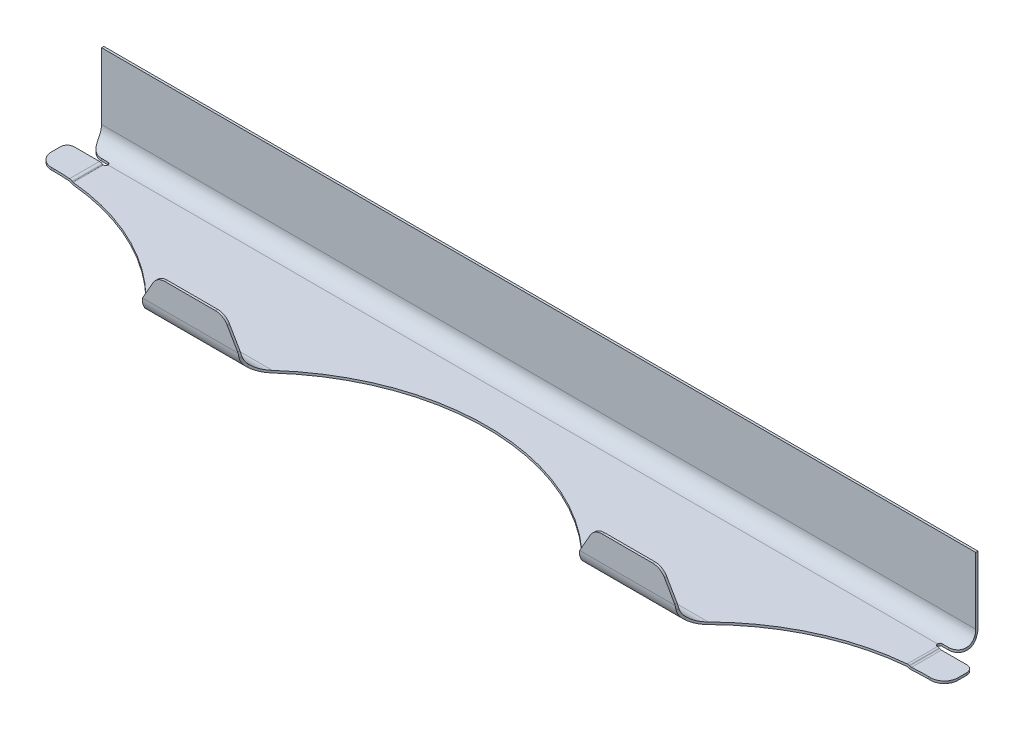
SolidWorks part; units mm, degrees
ref_plane "Front Plane" through (0, 0, 0) normal (1, 0, 0) x (0, 1, 0)
ref_plane "Top Plane" through (0, 0, 0) normal (0, 0, 1) x (0, 1, 0)
ref_plane "Right Plane" through (0, 0, 0) normal (0, 1, 0) x (-1, 0, 0)
sketch "sk 5dia hole pat" plane through (0, 0, 0) normal (0, 0, 1) x (0, 1, 0)
  line L4 (-30.48, -48.26) -> (30.48, -48.26) construction
  point P3 (0, -48.26)
  circle B0 centre (30.48, -579.12) radius 4.826
  circle B1 centre (1188.72, 579.12) radius 4.826
  circle B2 centre (78.74, -579.12) radius 4.826
  circle B3 centre (127, -579.12) radius 4.826
  circle B4 centre (175.26, -579.12) radius 4.826
  circle B5 centre (223.52, -579.12) radius 4.826
  circle B6 centre (271.78, -579.12) radius 4.826
  circle B7 centre (320.04, -579.12) radius 4.826
  circle B8 centre (368.3, -579.12) radius 4.826
  circle B9 centre (416.56, -579.12) radius 4.826
  circle B10 centre (464.82, -579.12) radius 4.826
  circle B11 centre (513.08, -579.12) radius 4.826
  circle B12 centre (561.34, -579.12) radius 4.826
  circle B13 centre (609.6, -579.12) radius 4.826
  circle B14 centre (657.86, -579.12) radius 4.826
  circle B15 centre (706.12, -579.12) radius 4.826
  circle B16 centre (754.38, -579.12) radius 4.826
  circle B17 centre (802.64, -579.12) radius 4.826
  circle B18 centre (850.9, -579.12) radius 4.826
  circle B19 centre (899.16, -579.12) radius 4.826
  circle B20 centre (947.42, -579.12) radius 4.826
  circle B21 centre (995.68, -579.12) radius 4.826
  circle B22 centre (1043.94, -579.12) radius 4.826
  circle B23 centre (1092.2, -579.12) radius 4.826
  circle B24 centre (1140.46, -579.12) radius 4.826
  circle B25 centre (1188.72, -579.12) radius 4.826
  circle B26 centre (30.48, -530.86) radius 4.826
  circle B27 centre (30.48, -482.6) radius 4.826
  circle B28 centre (30.48, -434.34) radius 4.826
  circle B29 centre (30.48, -386.08) radius 4.826
  circle B30 centre (30.48, -337.82) radius 4.826
  circle B31 centre (30.48, -289.56) radius 4.826
  circle B32 centre (30.48, -241.3) radius 4.826
  circle B33 centre (30.48, -193.04) radius 4.826
  circle B34 centre (30.48, -144.78) radius 4.826
  circle B35 centre (30.48, -96.52) radius 4.826
  circle B36 centre (30.48, -48.26) radius 4.826
  circle B37 centre (30.48, 0) radius 4.826
  circle B38 centre (30.48, 48.26) radius 4.826
  circle B39 centre (30.48, 96.52) radius 4.826
  circle B40 centre (30.48, 144.78) radius 4.826
  circle B41 centre (30.48, 193.04) radius 4.826
  circle B42 centre (30.48, 241.3) radius 4.826
  circle B43 centre (30.48, 289.56) radius 4.826
  circle B44 centre (30.48, 337.82) radius 4.826
  circle B45 centre (30.48, 386.08) radius 4.826
  circle B46 centre (30.48, 434.34) radius 4.826
  circle B47 centre (30.48, 482.6) radius 4.826
  circle B48 centre (30.48, 530.86) radius 4.826
  circle B49 centre (30.48, 579.12) radius 4.826
  circle B50 centre (1140.46, 579.12) radius 4.826
  circle B51 centre (1092.2, 579.12) radius 4.826
  circle B52 centre (1043.94, 579.12) radius 4.826
  circle B53 centre (995.68, 579.12) radius 4.826
  circle B54 centre (947.42, 579.12) radius 4.826
  circle B55 centre (899.16, 579.12) radius 4.826
  circle B56 centre (850.9, 579.12) radius 4.826
  circle B57 centre (802.64, 579.12) radius 4.826
  circle B58 centre (754.38, 579.12) radius 4.826
  circle B59 centre (706.12, 579.12) radius 4.826
  circle B60 centre (657.86, 579.12) radius 4.826
  circle B61 centre (609.6, 579.12) radius 4.826
  circle B62 centre (561.34, 579.12) radius 4.826
  circle B63 centre (513.08, 579.12) radius 4.826
  circle B64 centre (464.82, 579.12) radius 4.826
  circle B65 centre (416.56, 579.12) radius 4.826
  circle B66 centre (368.3, 579.12) radius 4.826
  circle B67 centre (320.04, 579.12) radius 4.826
  circle B68 centre (271.78, 579.12) radius 4.826
  circle B69 centre (223.52, 579.12) radius 4.826
  circle B70 centre (175.26, 579.12) radius 4.826
  circle B71 centre (127, 579.12) radius 4.826
  circle B72 centre (78.74, 579.12) radius 4.826
  circle B73 centre (1188.72, 530.86) radius 4.826
  circle B74 centre (1188.72, 482.6) radius 4.826
  circle B75 centre (1188.72, 434.34) radius 4.826
  circle B76 centre (1188.72, 386.08) radius 4.826
  circle B77 centre (1188.72, 337.82) radius 4.826
  circle B78 centre (1188.72, 289.56) radius 4.826
  circle B79 centre (1188.72, 241.3) radius 4.826
  circle B80 centre (1188.72, 193.04) radius 4.826
  circle B81 centre (1188.72, 144.78) radius 4.826
  circle B82 centre (1188.72, 96.52) radius 4.826
  circle B83 centre (1188.72, 48.26) radius 4.826
  circle B84 centre (1188.72, 0) radius 4.826
  circle B85 centre (1188.72, -48.26) radius 4.826
  circle B86 centre (1188.72, -96.52) radius 4.826
  circle B87 centre (1188.72, -144.78) radius 4.826
  circle B88 centre (1188.72, -193.04) radius 4.826
  circle B89 centre (1188.72, -241.3) radius 4.826
  circle B90 centre (1188.72, -289.56) radius 4.826
  circle B91 centre (1188.72, -337.82) radius 4.826
  circle B92 centre (1188.72, -386.08) radius 4.826
  circle B93 centre (1188.72, -434.34) radius 4.826
  circle B94 centre (1188.72, -482.6) radius 4.826
  circle B95 centre (1188.72, -530.86) radius 4.826
  line B96 (609.6, -579.12) -> (609.6, -504.12) construction
  line B97 (30.48, 0) -> (105.48, 0) construction
  circle B98 centre (-30.48, 579.12) radius 4.826
  circle B99 centre (-175.26, -579.12) radius 4.826
  circle B100 centre (-127, -579.12) radius 4.826
  circle B101 centre (-30.48, -579.12) radius 4.826
  circle B102 centre (-1188.72, 96.52) radius 4.826
  circle B103 centre (-127, 579.12) radius 4.826
  circle B104 centre (-464.82, 579.12) radius 4.826
  circle B105 centre (-513.08, 579.12) radius 4.826
  circle B106 centre (-706.12, 579.12) radius 4.826
  circle B107 centre (-754.38, 579.12) radius 4.826
  circle B108 centre (-899.16, 579.12) radius 4.826
  circle B109 centre (-30.48, 530.86) radius 4.826
  circle B110 centre (-30.48, 482.6) radius 4.826
  circle B111 centre (-30.48, 434.34) radius 4.826
  circle B112 centre (-30.48, 386.08) radius 4.826
  circle B113 centre (-30.48, 337.82) radius 4.826
  circle B114 centre (-30.48, 289.56) radius 4.826
  circle B115 centre (-30.48, 241.3) radius 4.826
  circle B116 centre (-30.48, 193.04) radius 4.826
  circle B117 centre (-30.48, 144.78) radius 4.826
  circle B118 centre (-30.48, 96.52) radius 4.826
  circle B119 centre (-30.48, 48.26) radius 4.826
  circle B120 centre (-30.48, 0) radius 4.826
  circle B121 centre (-30.48, -48.26) radius 4.826
  circle B122 centre (-30.48, -96.52) radius 4.826
  circle B123 centre (-30.48, -144.78) radius 4.826
  circle B124 centre (-30.48, -241.3) radius 4.826
  circle B125 centre (-30.48, -289.56) radius 4.826
  circle B126 centre (-30.48, -337.82) radius 4.826
  circle B127 centre (-30.48, -386.08) radius 4.826
  circle B128 centre (-30.48, -434.34) radius 4.826
  circle B129 centre (-30.48, -482.6) radius 4.826
  circle B130 centre (-30.48, -530.86) radius 4.826
  line B131 (-1188.72, 0) -> (-1113.72, 0) construction
  dimension "D1" = 60.96
sketch_block_instance "5dia hole pat-1"
sketch_block "5dia hole pat" parameters "D1"=9.652, "D2"=9.652, "D3"=75
sketch_block_instance "5dia hole pat-2"
sketch "sk 47.986in pnl" plane through (0, 0, 0) normal (0, 0, 1) x (0, 1, 0)
  line B0 (0.1778, 0) -> (1219.0222, 0) construction
  line B1 (0.1778, 609.4222) -> (1219.0222, 609.4222)
  line B2 (0.1778, 609.4222) -> (0.1778, -609.4222)
  line B3 (0.1778, -609.4222) -> (1219.0222, -609.4222)
  line B4 (1219.0222, 609.4222) -> (1219.0222, -609.4222)
  line B5 (609.6, 609.4222) -> (609.6, -609.4222) construction
  dimension "D1" = 30.3022
sketch_block_instance "47.986in pnl-1"
sketch_block "47.986in pnl" parameters "D1"=1218.8444, "D2"=1218.8444
sketch "sk main body" plane through (0, 0, 0) normal (1, 0, 0) x (0, 1, 0)
  line L0 (49.53, 0) -> (-43.18, 0)
  line L1 (-68.58, 25.4) -> (-68.58, 158.75)
  line L2 (-43.18, 184.15) -> (-7.62, 184.15)
  line L3 (-26.67, 213.8401) -> (-26.67, 147.2198) construction
  line L4 (49.53, 3.175) -> (-43.18, 3.175)
  line L5 (-65.405, 25.4) -> (-65.405, 158.75)
  line L6 (-43.18, 180.975) -> (-7.62, 180.975)
  line L7 (-7.62, 184.15) -> (-7.62, 180.975)
  line L8 (49.53, 3.175) -> (49.53, 0)
  line L9 (670.3644, 0) -> (-670.3644, 0) construction
  arc A0 (-43.18, 0) -> (-68.58, 25.4) centre (-43.18, 25.4) cw
  arc A1 (-68.58, 158.75) -> (-43.18, 184.15) centre (-43.18, 158.75) cw
  arc A2 (-43.18, 3.175) -> (-65.405, 25.4) centre (-43.18, 25.4) cw
  arc A3 (-65.405, 158.75) -> (-43.18, 180.975) centre (-43.18, 158.75) cw
  dimension "D2" = 25.4
  dimension "D1" = 19.05
  dimension "D3" = 12.7
  dimension "D4" = 16.51
  dimension "D5" = 19.05
  dimension "D7" = 177.8
  dimension "D6" = 3.175
extrude "main body" add sketch "sk main body" along normal mid plane 1218.8444
sketch "sk upper holes" plane through (0, 0, 184.15) normal (0, 0, 1) x (1, 0, 0)
  line L0 (-609.4222, 0.1778) -> (-609.4222, 1219.0222) construction
  line L1 (609.4222, 0.1778) -> (609.4222, 1219.0222) construction
  line L2 (609.4222, -7.62) -> (-609.4222, -7.62) construction
  circle A2 centre (-342.9, -26.67) radius 16.51 construction
  circle A3 centre (-266.7, -26.67) radius 16.51 construction
  circle A4 centre (266.7, -26.67) radius 16.51 construction
  circle A5 centre (342.9, -26.67) radius 16.51 construction
  line B0 (-342.9, -26.67) -> (-266.7, -26.67) construction
  circle B1 centre (-342.9, -26.67) radius 7.1438
  circle B2 centre (-266.7, -26.67) radius 7.1438
  line B3 (266.7, -26.67) -> (342.9, -26.67) construction
  circle B4 centre (266.7, -26.67) radius 7.1438
  circle B5 centre (342.9, -26.67) radius 7.1438
  dimension "D1" = 304.8
  dimension "D2" = 304.8
  dimension "D6" = 33.02
  dimension "D7" = 33.02
  dimension "D8" = 33.02
  dimension "D9" = 33.02
  dimension "D3" = 304.6222
  dimension "D4" = 304.6222
  dimension "D5" = 19.05
sketch_block_instance "Upper bolt holes-1"
sketch_block "Upper bolt holes" parameters "D1"=14.2875, "D2"=14.2875, "D3"=76.2
sketch_block_instance "Upper bolt holes-2"
sketch "Sketch6" plane through (0, 0, 184.15) normal (0, 0, 1) x (1, 0, 0)
  line L0 (-371.4962, -43.18) -> (-304.8, 72.3411)
  line L1 (609.4222, -43.18) -> (-609.4222, -43.18) construction
  line L2 (-304.8, 72.3411) -> (-238.1038, -43.18)
  line L3 (-371.4962, -43.18) -> (-638.8127, -43.18)
  line L4 (-638.8127, -43.18) -> (-638.8127, 115.8831)
  line L6 (238.1038, -43.18) -> (304.8, 72.3411)
  line L7 (304.8, 72.3411) -> (371.4962, -43.18)
  line L8 (371.4962, -43.18) -> (645.1619, -43.18)
  line L9 (645.1619, -43.18) -> (645.1619, 115.8831)
  line L10 (-238.1038, -43.18) -> (238.1038, -43.18)
  line L11 (-638.8127, 115.8831) -> (645.1619, 115.8831)
  circle A0 centre (-342.9, -26.67) radius 16.51 construction
  circle A1 centre (-266.7, -26.67) radius 16.51 construction
  circle A2 centre (342.9, -26.67) radius 16.51 construction
  circle A3 centre (266.7, -26.67) radius 16.51 construction
  dimension "D1" = 60
  dimension "D2" = 60
  dimension "D3" = 60
  dimension "D4" = 60
extrude "Upper tabs" cut sketch "Sketch6" against normal blind 10
sketch "Sketch7" plane through (0, 0, 0) normal (0, 1, 0) x (-1, 0, 0)
  line L0 (-238.1038, 180.975) -> (-238.1038, 196.2087)
  line L4 (-238.1038, 196.2087) -> (238.1038, 196.2087)
  line L5 (238.1038, 196.2087) -> (238.1038, 180.975)
  line L6 (-609.4222, 25.4) -> (609.4222, 25.4) construction
  arc A2 (-238.1038, 180.975) -> (238.1038, 180.975) centre (0, 399.136) ccw
  point P2 (0, 76.2)
  dimension "D1" = 50.8
extrude "Side Mid curve" cut sketch "Sketch7" against normal through all
sketch "5dia hole for part" plane through (0, 0, 0) normal (0, 0, 1) x (0, 1, 0)
  circle A0 centre (-30.48, -579.12) radius 4.826
  circle A1 centre (30.48, -579.12) radius 4.826
  circle A2 centre (-30.48, -579.12) radius 4.826 construction
  circle A3 centre (30.48, -579.12) radius 4.826 construction
  circle A4 centre (-30.48, -530.86) radius 4.826
  circle A5 centre (30.48, -530.86) radius 4.826
  circle A6 centre (-30.48, -482.6) radius 4.826
  circle A7 centre (30.48, -482.6) radius 4.826
  circle A8 centre (-30.48, -434.34) radius 4.826
  circle A9 centre (30.48, -434.34) radius 4.826
  circle A10 centre (-30.48, -386.08) radius 4.826
  circle A11 centre (30.48, -386.08) radius 4.826
  circle A12 centre (-30.48, -337.82) radius 4.826
  circle A13 centre (30.48, -337.82) radius 4.826
  circle A14 centre (-30.48, -289.56) radius 4.826
  circle A15 centre (30.48, -289.56) radius 4.826
  circle A16 centre (-30.48, -241.3) radius 4.826
  circle A17 centre (30.48, -241.3) radius 4.826
  circle A18 centre (-30.48, -193.04) radius 4.826
  circle A19 centre (30.48, -193.04) radius 4.826
  circle A20 centre (-30.48, -144.78) radius 4.826
  circle A21 centre (30.48, -144.78) radius 4.826
  circle A22 centre (-30.48, -96.52) radius 4.826
  circle A23 centre (30.48, -96.52) radius 4.826
  circle A24 centre (-30.48, -48.26) radius 4.826
  circle A25 centre (30.48, -48.26) radius 4.826
  circle A26 centre (-30.48, 0) radius 4.826
  circle A27 centre (30.48, 0) radius 4.826
  circle A28 centre (-30.48, 48.26) radius 4.826
  circle A29 centre (30.48, 48.26) radius 4.826
  circle A30 centre (-30.48, 96.52) radius 4.826
  circle A31 centre (30.48, 96.52) radius 4.826
  circle A32 centre (-30.48, 144.78) radius 4.826
  circle A33 centre (30.48, 144.78) radius 4.826
  circle A34 centre (-30.48, 193.04) radius 4.826
  circle A35 centre (30.48, 193.04) radius 4.826
  circle A36 centre (-30.48, 241.3) radius 4.826
  circle A37 centre (30.48, 241.3) radius 4.826
  circle A38 centre (-30.48, 289.56) radius 4.826
  circle A39 centre (30.48, 289.56) radius 4.826
  circle A40 centre (-30.48, 337.82) radius 4.826
  circle A41 centre (30.48, 337.82) radius 4.826
  circle A42 centre (-30.48, 386.08) radius 4.826
  circle A43 centre (30.48, 386.08) radius 4.826
  circle A44 centre (-30.48, 434.34) radius 4.826
  circle A45 centre (30.48, 434.34) radius 4.826
  circle A46 centre (-30.48, 482.6) radius 4.826
  circle A47 centre (30.48, 482.6) radius 4.826
  circle A48 centre (-30.48, 530.86) radius 4.826
  circle A49 centre (30.48, 530.86) radius 4.826
  circle A50 centre (-30.48, 579.12) radius 4.826
  circle A51 centre (30.48, 579.12) radius 4.826
  dimension "D1" = 25
extrude "Holes Bot" [suppressed] cut sketch "5dia hole for part" along normal blind 10
extrude "Holes Top" [suppressed] cut sketch "sk upper holes" against normal blind 10
ref_plane "Tab Lower pln" through (0, 0, 25.4) normal (0, 0, 1) x (0, 1, 0)
sketch "sk Rivet holes" plane through (0, 0, 0) normal (0, 1, 0) x (-1, 0, 0)
  line L1 (609.4222, 0) -> (609.4222, 3.175) construction
  line L3 (64.9605, 25.4) -> (-64.9605, 25.4) construction
  line L5 (-609.4222, 25.4) -> (-609.4222, 158.75) construction
  circle A0 centre (622.3, 37.4) radius 10 construction
  circle A1 centre (609.6, 59.397) radius 10 construction
  circle A2 centre (596.9, 37.4) radius 10 construction
  circle A3 centre (-609.6, 59.397) radius 10 construction
  circle A4 centre (-596.9, 37.4) radius 10 construction
  circle A6 centre (-622.3, 37.4) radius 10 construction
  point P5 (622.3, 34.8092)
  point P9 (622.3, 27.4)
  point P20 (632.3, 37.4)
  point P21 (-632.3, 37.4)
  point P22 (586.9, 37.4)
  point P23 (-586.9, 37.4)
  point P24 (609.6, 69.397)
  point P25 (-609.6, 69.397)
  line B0 (596.9, 37.4) -> (609.6, 59.397) construction
  line B1 (609.6, 59.397) -> (622.3, 37.4) construction
  line B2 (622.3, 37.4) -> (596.9, 37.4) construction
  circle B3 centre (596.9, 37.4) radius 2.5908
  circle B4 centre (622.3, 37.4) radius 2.5908
  circle B5 centre (609.6, 59.397) radius 2.5908
  line B6 (603.25, 48.3985) -> (609.6, 44.7323) construction
  line B7 (609.6, 37.4) -> (609.6, 44.7323) construction
  line B8 (-622.3, 37.4) -> (-609.6, 59.397) construction
  line B9 (-609.6, 59.397) -> (-596.9, 37.4) construction
  line B10 (-596.9, 37.4) -> (-622.3, 37.4) construction
  circle B11 centre (-622.3, 37.4) radius 2.5908
  circle B12 centre (-596.9, 37.4) radius 2.5908
  circle B13 centre (-609.6, 59.397) radius 2.5908
  line B14 (-615.95, 48.3985) -> (-609.6, 44.7323) construction
  line B15 (-609.6, 37.4) -> (-609.6, 44.7323) construction
  dimension "D4" = 20
  dimension "D6" = 20
  dimension "D7" = 20
  dimension "D8" = 20
  dimension "D9" = 20
  dimension "D10" = 20
  dimension "D1" = 0.1778
  dimension "D2" = 12
  dimension "D3" = 0.1778
  dimension "D5" = 7.4092
sketch_block_instance "Blind Rivet holes-1"
sketch_block "Blind Rivet holes" parameters "D1"=5.1816, "D2"=5.1816, "D3"=5.1816, "D4"=60, "D5"=60, "D6"=25.4, "D7"=25.4, "D8"=25.4
sketch_block_instance "Blind Rivet holes-2"
sketch "sk Vtab" plane through (0, 0, 25.4) normal (0, 0, 1) x (0, 1, 0)
  line L8 (-68.58, -609.4222) -> (-68.58, 609.4222) construction
  line B0 (-68.58, 579.4709) -> (-68.58, 581.4709)
  line B1 (-67.9101, 583.9709) -> (-67.6624, 584.4)
  line B2 (-66.9925, 586.9) -> (-66.9925, 631.9)
  line B3 (-65.405, 579.4709) -> (-65.405, 581.4709)
  line B4 (-65.1605, 582.3834) -> (-64.9127, 582.8125)
  line B5 (-63.8175, 586.9) -> (-63.8175, 631.9)
  line B6 (-68.58, 579.4709) -> (-65.405, 579.4709)
  line B7 (-63.8175, 631.9) -> (-66.9925, 631.9)
  arc B8 (-67.6624, 584.4) -> (-66.9925, 586.9) centre (-71.9925, 586.9) ccw
  arc B9 (-68.58, 581.4709) -> (-67.9101, 583.9709) centre (-63.58, 581.4709) cw
  arc B10 (-65.405, 581.4709) -> (-65.1605, 582.3834) centre (-63.58, 581.4709) cw
  arc B11 (-64.9127, 582.8125) -> (-63.8175, 586.9) centre (-71.9925, 586.9) ccw
  line B12 (-65.405, -579.4709) -> (-65.405, -581.4709)
  line B13 (-66.0749, -583.9709) -> (-66.3226, -584.4)
  line B14 (-66.9925, -586.9) -> (-66.9925, -631.9)
  line B15 (-68.58, -579.4709) -> (-68.58, -581.4709)
  line B16 (-68.8245, -582.3834) -> (-69.0723, -582.8125)
  line B17 (-70.1675, -586.9) -> (-70.1675, -631.9)
  line B18 (-65.405, -579.4709) -> (-68.58, -579.4709)
  line B19 (-70.1675, -631.9) -> (-66.9925, -631.9)
  arc B20 (-66.3226, -584.4) -> (-66.9925, -586.9) centre (-61.9925, -586.9) ccw
  arc B21 (-65.405, -581.4709) -> (-66.0749, -583.9709) centre (-70.405, -581.4709) cw
  arc B22 (-68.58, -581.4709) -> (-68.8245, -582.3834) centre (-70.405, -581.4709) cw
  arc B23 (-69.0723, -582.8125) -> (-70.1675, -586.9) centre (-61.9925, -586.9) ccw
sketch_block_instance "V tab-1"
sketch_block "V tab" parameters "D3"=5, "D1"=30, "D2"=1.5875, "D4"=2, "D5"=24.625
sketch_block_instance "V tab-2"
sketch "sk Vtab precut" plane through (0, 0, 25.4) normal (0, 0, 1) x (0, 1, 0)
  line L1 (-68.58, 581.4709) -> (-25.5629, 581.4709)
  line L2 (-68.58, 581.4709) -> (-68.58, 628.7058)
  line L3 (-68.58, 628.7058) -> (-25.5629, 628.7058)
  line L4 (-25.5629, 581.4709) -> (-25.5629, 628.7058)
  line L5 (-68.58, -581.4709) -> (-35.8904, -581.4709)
  line L6 (-68.58, -581.4709) -> (-68.58, -622.8382)
  line L7 (-68.58, -622.8382) -> (-35.8904, -622.8382)
  line L8 (-35.8904, -581.4709) -> (-35.8904, -622.8382)
sketch "Sketch9" plane through (0, 0, 0) normal (0, 1, 0) x (-1, 0, 0)
  line L6 (371.4962, 180.975) -> (371.4962, 193.3104)
  line L7 (371.4962, 193.3104) -> (736.1624, 193.3104)
  line L8 (736.1624, 193.3104) -> (736.1624, 69.397)
  line L9 (736.1624, 69.397) -> (609.6, 69.397)
  line L10 (-371.4962, 180.975) -> (-371.4962, 190.6931)
  line L11 (-371.4962, 190.6931) -> (-686.7988, 190.6931)
  line L12 (-686.7988, 190.6931) -> (-686.7988, 69.397)
  line L13 (-686.7988, 69.397) -> (-609.6, 69.397)
  arc A2 (371.4962, 180.975) -> (609.6, 69.397) centre (609.6, 379.2391) ccw
  arc A3 (-371.4962, 180.975) -> (-609.6, 69.397) centre (-609.6, 379.2391) cw
  circle A4 centre (-609.6, 59.397) radius 10 construction
extrude "Cut-Extrude5" cut sketch "sk Vtab precut" along normal through all
extrude "Side Tabs" add sketch "sk Vtab" along normal blind 50
sketch "Sketch11" plane through (0, 0, 0) normal (0, 1, 0) x (-1, 0, 0)
  line L0 (581.4709, 25.4) -> (667.6325, 25.4) construction
  line L1 (581.4709, 28.575) -> (667.6325, 28.575)
  line L2 (581.4709, 22.225) -> (667.6325, 22.225)
  line L4 (-581.4709, 25.4) -> (581.4709, 25.4) construction
  line L5 (581.4709, 75.4) -> (581.4709, 25.4) construction
  line L6 (-581.4709, 25.4) -> (-658.6998, 25.4) construction
  line L7 (-581.4709, 22.225) -> (-658.6998, 22.225)
  line L8 (-581.4709, 28.575) -> (-658.6998, 28.575)
  line L9 (-581.4709, 25.4) -> (-581.4709, 75.4) construction
  arc A0 (581.4709, 28.575) -> (581.4709, 22.225) centre (581.4709, 25.4) ccw
  arc A1 (667.6325, 22.225) -> (667.6325, 28.575) centre (667.6325, 25.4) ccw
  arc A2 (-581.4709, 22.225) -> (-581.4709, 28.575) centre (-581.4709, 25.4) ccw
  arc A3 (-658.6998, 28.575) -> (-658.6998, 22.225) centre (-658.6998, 25.4) ccw
  point P2 (624.5517, 25.4)
  point P7 (-620.0853, 25.4)
  dimension "D1" = 3.175
  dimension "D2" = 3.175
extrude "tab undercut" cut sketch "Sketch11" against normal through all
extrude "Outer curve cut" cut sketch "Sketch9" against normal through all
fillet "Fillet1" radius 19.05 12 edges at (-609.4222, -66.7789, 22.225) (609.4222, -66.7789, 22.225) (631.9, -68.58, 69.397) (-631.9, -65.405, 69.397) (-371.4962, -49.3284, 180.975) (-238.1038, -49.3284, 180.975) (371.4962, -49.3284, 180.975) (238.1038, -49.3284, 180.975) (350.9656, -7.62, 182.5625) (258.6344, -7.62, 182.5625) (-258.6344, -7.62, 182.5625) (-350.9656, -7.62, 182.5625)
fillet "Fillet3" radius 9.525 6 edges at (631.9, -68.58, 28.575) (-631.9, -65.405, 28.575) (237.1094, -44.9024, 182.4383) (372.3141, -44.5968, 182.4697) (-237.1094, -44.9024, 182.4383) (-372.3141, -44.5968, 182.4697)
extrude "Tab Holes" [suppressed] cut sketch "sk Rivet holes" against normal through all
equation "\"3i\"=138.375"
equation "\".75i\"=12.7"
